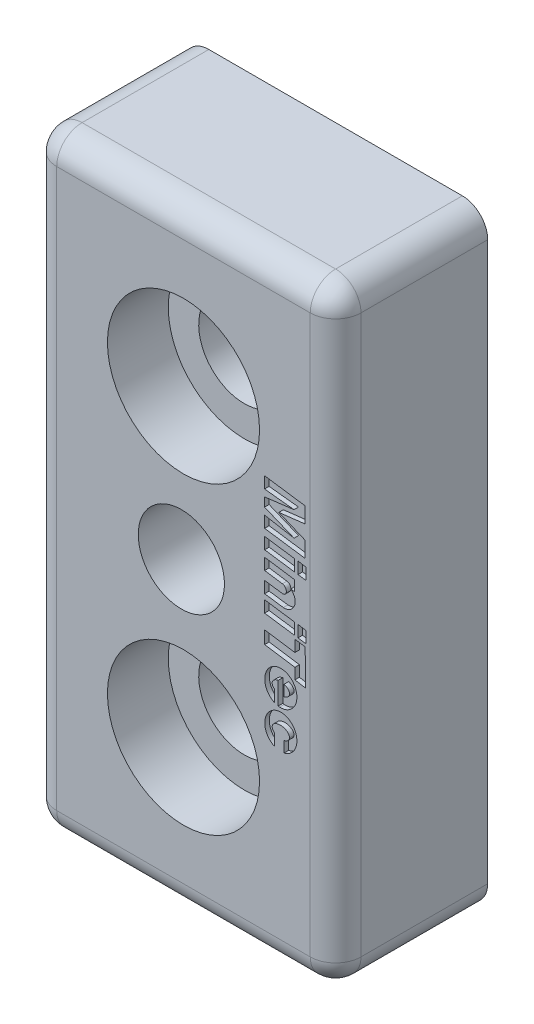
SolidWorks part; units mm, degrees
ref_plane "Front Plane" through (0, 0, 0) normal (0, 0, 1) x (1, 0, 0)
ref_plane "Top Plane" through (0, 0, 0) normal (0, 1, 0) x (1, 0, 0)
ref_plane "Right Plane" through (0, 0, 0) normal (1, 0, 0) x (0, 0, -1)
imported_body "Imported1"
hole_wizard "M8x1.25 Tapped Hole" positions "3DSketch3" profile "Sketch5" tap size "M10x1.5" standard "Ansi Metric"
sketch3d "3DSketch3"
  line L1 (-12.459, 45.5583, 12.5) -> (12.541, 45.5583, 12.5) construction
  line L2 (-14.959, -11.9417, 12.5) -> (-14.959, 43.0583, 12.5) construction
  point P2 (-0.1688, 15.6626, 15)
  dimension "D1" = 30
  dimension "D2" = 15
sketch "Sketch5" plane through (-0.1688, 15.6626, 15) normal (1, 0, 0) x (0, -1, 0)
  line L0 (0, 0) -> (0, 30.0537)
  line L1 (0, 30.0537) -> (4.25, 27.5)
  line L2 (4.25, 27.5) -> (4.25, 0)
  line L5 (4.25, 0) -> (0, 0)
  line L10 (0, 30.0537) -> (-4.25, 27.5) construction
  line L11 (0, -6.35) -> (0, 107.95) construction
  dimension "Tap Drill Dia." = 8.5
  dimension "Tap Drill Depth" = 27.5
  dimension "Drill Angle" = 118
